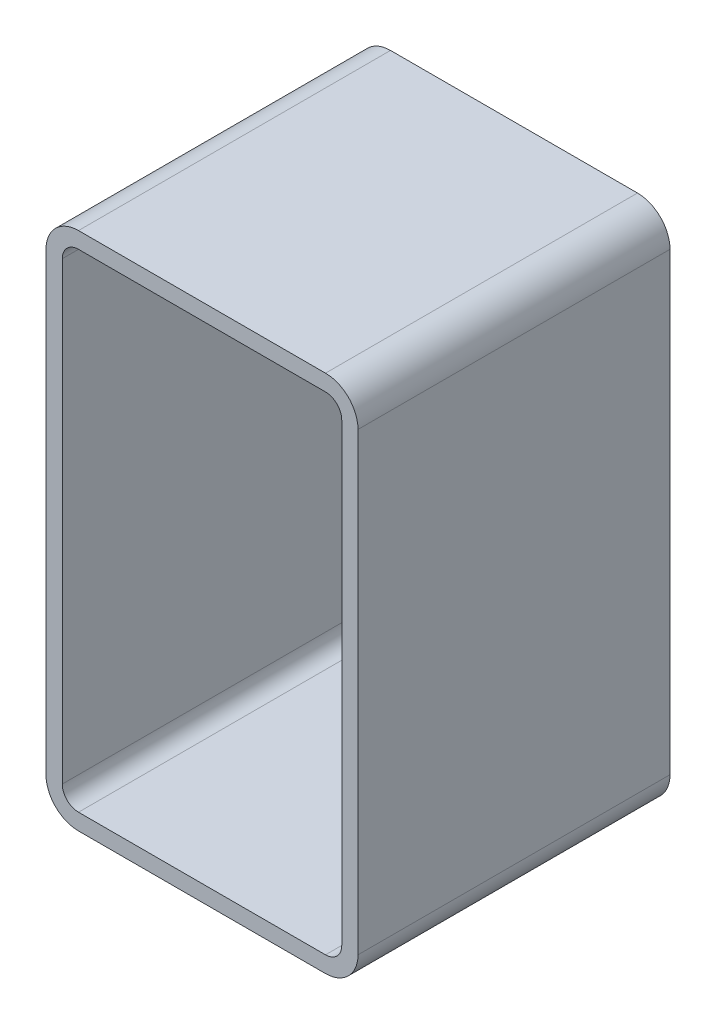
SolidWorks part; units mm, degrees
ref_plane "Front Plane" through (0, 0, 0) normal (0, 0, 1) x (1, 0, 0)
ref_plane "Top Plane" through (0, 0, 0) normal (0, 1, 0) x (1, 0, 0)
ref_plane "Right Plane" through (0, 0, 0) normal (1, 0, 0) x (0, 0, -1)
sketch "Sketch1" plane through (0, 0, 0) normal (0, 0, 1) x (1, 0, 0)
sketch_block_instance "HSS20x12x0.625-1"
sketch_block "HSS20x12x0.625"
extrude "Boss-Extrude1" add sketch "Sketch1" along normal blind 304.8
